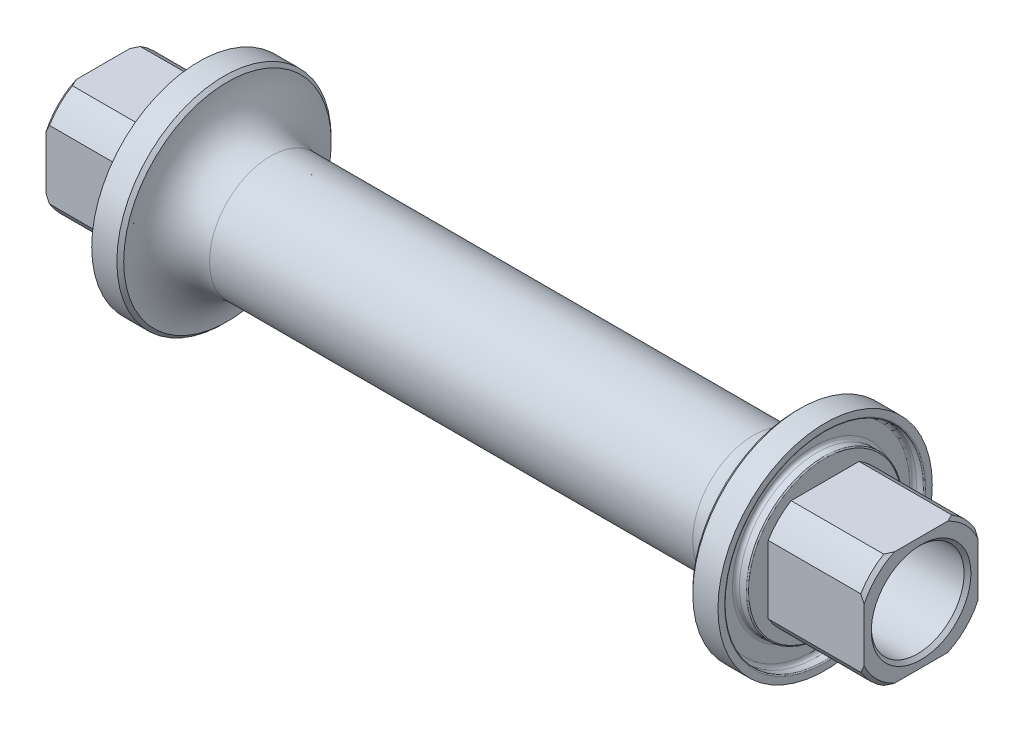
SolidWorks part; units mm, degrees
ref_plane "Front" through (0, 0, 0) normal (0, 0, 1) x (1, 0, 0)
ref_plane "Top" through (0, 0, 0) normal (0, 1, 0) x (1, 0, 0)
ref_plane "Right" through (0, 0, 0) normal (1, 0, 0) x (0, 0, -1)
sketch "Sketch1" plane through (0, 0, 0) normal (0, 0, 1) x (1, 0, 0)
  line L0 (0, 0) -> (69.596, 0) construction
  line L1 (0, 0) -> (0, 11.9126)
  line L2 (0, 11.9126) -> (3.175, 11.9126)
  line L3 (0, 0) -> (69.596, 0)
  line L4 (3.175, 6.7691) -> (66.421, 6.7691)
  line L5 (3.175, 6.7691) -> (3.175, 11.9126)
  line L6 (66.421, 6.7691) -> (66.421, 11.9126)
  line L7 (69.596, 11.9126) -> (66.421, 11.9126)
  line L8 (69.596, 0) -> (69.596, 11.9126)
  dimension "D1" = 69.596
  dimension "D2" = 11.9126
  dimension "D3" = 3.175
  dimension "D4" = 3.175
  dimension "D5" = 63.246
revolve "Base-Revolve" add sketch "Sketch1" angle 360 about L0
fillet "Fillet1" radius 4.7752
chamfer "Chamfer1" distance 0.381 angle 45
sketch "Sketch2" plane through (0, 0, 0) normal (-1, 0, 0) x (0, 0, 1)
  circle A0 centre (0, 0) radius 8.636
  circle A1 centre (0, 0) radius 11.049
  dimension "D1" = 17.272
  dimension "D2" = 2.413
extrude "Cut-Extrude1" cut sketch "Sketch2" against normal blind 1.27
sketch "Sketch3" plane through (69.596, 0, 0) normal (1, 0, 0) x (0, 0, -1)
  circle A0 centre (0, 0) radius 8.636
  circle A1 centre (0, 0) radius 11.049
  dimension "D1" = 17.272
  dimension "D2" = 2.413
extrude "Cut-Extrude2" cut sketch "Sketch3" against normal blind 1.27
sketch "Sketch4" plane through (0, 0, 0) normal (-1, 0, 0) x (0, 0, 1)
  line L0 (0, 10.3265) -> (0, -13.5926) construction
  line L1 (12.9682, 0) -> (-15.1776, 0) construction
  line L2 (3.7759, 6.3246) -> (-3.7759, 6.3246)
  line L3 (6.3246, 3.7759) -> (6.3246, -3.7759)
  line L4 (-6.3246, 3.7759) -> (-6.3246, -3.7759)
  line L5 (3.7759, -6.3246) -> (-3.7759, -6.3246)
  arc A0 (6.3246, 3.7759) -> (3.7759, 6.3246) centre (0, 0) ccw
  arc A1 (-3.7759, 6.3246) -> (-6.3246, 3.7759) centre (0, 0) ccw
  arc A2 (-6.3246, -3.7759) -> (-3.7759, -6.3246) centre (0, 0) ccw
  arc A3 (3.7759, -6.3246) -> (6.3246, -3.7759) centre (0, 0) ccw
  dimension "D1" = 14.732
  dimension "D2" = 6.3246
  dimension "D3" = 6.3246
  dimension "D4" = 6.3246
  dimension "D5" = 6.3246
extrude "Boss-Extrude1" add sketch "Sketch4" along normal blind 10.668
sketch "Sketch5" plane through (69.596, 0, 0) normal (1, 0, 0) x (0, 0, -1)
  line L0 (0, 14.4571) -> (0, -15.3217) construction
  line L1 (16.2343, 0) -> (-18.924, 0) construction
  line L2 (3.7759, -6.3246) -> (-3.7759, -6.3246)
  line L3 (3.7759, 6.3246) -> (-3.7759, 6.3246)
  line L4 (6.3246, 3.7759) -> (6.3246, -3.7759)
  line L5 (-6.3246, 3.7759) -> (-6.3246, -3.7759)
  arc A0 (3.7759, -6.3246) -> (6.3246, -3.7759) centre (0, 0) ccw
  arc A1 (-6.3246, -3.7759) -> (-3.7759, -6.3246) centre (0, 0) ccw
  arc A2 (-3.7759, 6.3246) -> (-6.3246, 3.7759) centre (0, 0) ccw
  arc A3 (6.3246, 3.7759) -> (3.7759, 6.3246) centre (0, 0) ccw
  dimension "D1" = 14.732
  dimension "D2" = 6.3246
  dimension "D3" = 6.3246
  dimension "D4" = 6.3246
  dimension "D5" = 6.3246
extrude "Boss-Extrude2" add sketch "Sketch5" along normal blind 10.668
sketch "Sketch6" plane through (80.264, 0, 0) normal (1, 0, 0) x (0, 0, -1)
  circle A0 centre (0, 0) radius 5.1562
  dimension "D1" = 10.3124
extrude "Cut-Extrude3" cut sketch "Sketch6" against normal through all
chamfer "Chamfer2" distance 0.381 angle 45
fillet "Fillet2" radius 0.381
fillet "Fillet3" radius 0.127
